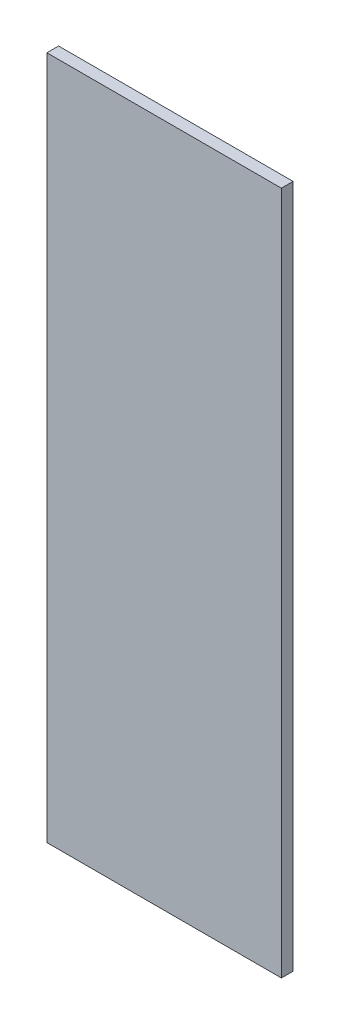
SolidWorks part; units mm, degrees
ref_plane "Front Plane" through (0, 0, 0) normal (0, 0, 1) x (1, 0, 0)
ref_plane "Top Plane" through (0, 0, 0) normal (0, 1, 0) x (1, 0, 0)
ref_plane "Right Plane" through (0, 0, 0) normal (1, 0, 0) x (0, 0, -1)
sketch "Sketch1" plane through (0, 0, 0) normal (0, 0, 1) x (1, 0, 0)
  line L1 (-30, 87.5) -> (30, 87.5)
  line L2 (-30, 87.5) -> (-30, -87.5)
  line L3 (-30, -87.5) -> (30, -87.5)
  line L4 (30, 87.5) -> (30, -87.5)
  line L5 (-30, 87.5) -> (30, -87.5) construction
  line L6 (-30, -87.5) -> (30, 87.5) construction
  point P0 (0, 0)
  dimension "D1" = 60
  dimension "D2" = 175
extrude "Boss-Extrude1" add sketch "Sketch1" along normal blind 3
